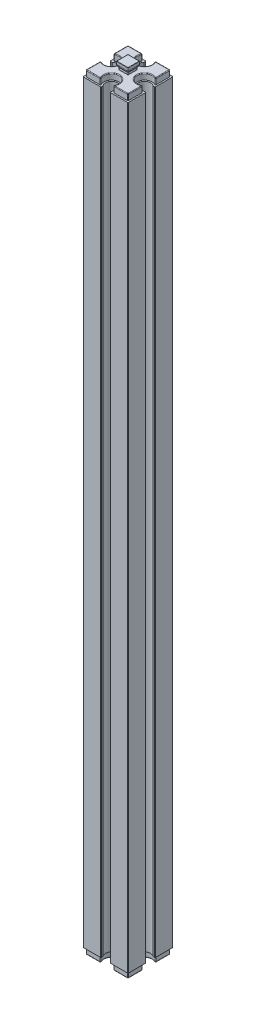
SolidWorks part; units mm, degrees
ref_plane "前视基准面" through (0, 0, 0) normal (0, 0, 1) x (1, 0, 0)
ref_plane "上视基准面" through (0, 0, 0) normal (0, 1, 0) x (1, 0, 0)
ref_plane "右视基准面" through (0, 0, 0) normal (1, 0, 0) x (0, 0, -1)
sketch "草图1" plane through (0, 0, 0) normal (0, 1, 0) x (1, 0, 0)
  line L0 (0, 0) -> (0, 7.5) construction
  line L1 (0, 0) -> (7.5, 0) construction
  line L2 (-7.5, 7.5) -> (-1.5, 7.5)
  line L3 (7.5, 7.5) -> (7.5, 1.5)
  line L4 (6.8229, 1.5) -> (7.5, 1.5)
  line L5 (6.8229, -1.5) -> (7.5, -1.5)
  line L6 (0, 7.5) -> (0, 5.5) construction
  line L7 (-1.5, 6.8229) -> (-1.5, 7.5)
  line L8 (1.5, 6.8229) -> (1.5, 7.5)
  line L9 (1.5, 7.5) -> (7.5, 7.5)
  line L10 (7.5, -1.5) -> (7.5, -7.5)
  line L11 (7.5, -7.5) -> (1.5, -7.5)
  line L12 (1.5, -6.8229) -> (1.5, -7.5)
  line L13 (-1.5, -6.8229) -> (-1.5, -7.5)
  line L14 (-1.5, -7.5) -> (-7.5, -7.5)
  line L15 (-7.5, -7.5) -> (-7.5, -1.5)
  line L16 (-6.8229, -1.5) -> (-7.5, -1.5)
  line L17 (-6.8229, 1.5) -> (-7.5, 1.5)
  line L18 (-7.5, 1.5) -> (-7.5, 7.5)
  arc A0 (-1.5, 6.8229) -> (1.5, 6.8229) centre (0, 5.5) ccw
  arc A1 (6.8229, 1.5) -> (6.8229, -1.5) centre (5.5, 0) ccw
  arc A2 (1.5, -6.8229) -> (-1.5, -6.8229) centre (0, -5.5) ccw
  arc A3 (-6.8229, -1.5) -> (-6.8229, 1.5) centre (-5.5, 0) ccw
  point P36 (0, 0)
  dimension "D6" = 4
  dimension "D7" = 2
  dimension "D1" = 7.5
  dimension "D2" = 7.5
  dimension "D3" = 2
  dimension "D4" = 7.5
  dimension "D5" = 1.5
extrude "凸台-拉伸1" add sketch "草图1" along normal blind 125.5
sketch "草图2" plane through (0, 125.5, 0) normal (0, 1, 0) x (1, 0, 0)
  line L0 (-7, 7) -> (-7, 2)
  line L1 (-7, 2) -> (-7, 2)
  line L2 (-7, -2) -> (-7, -2)
  line L3 (-7, -2) -> (-7, -7)
  line L4 (-7, -7) -> (-2, -7)
  line L5 (-2, -7) -> (-2, -7)
  line L6 (2, -7) -> (2, -7)
  line L7 (2, -7) -> (7, -7)
  line L8 (7, -7) -> (7, -2)
  line L9 (7, -2) -> (7, -2)
  line L10 (7, 2) -> (7, 2)
  line L11 (7, 2) -> (7, 7)
  line L12 (7, 7) -> (2, 7)
  line L13 (2, 7) -> (2, 7)
  line L14 (-2, 7) -> (-2, 7)
  line L15 (-2, 7) -> (-7, 7)
  line L16 (-7.5, 7.5) -> (-7.5, 1.5)
  line L17 (-7.5, 1.5) -> (-6.8229, 1.5)
  line L18 (-6.8229, -1.5) -> (-7.5, -1.5)
  line L19 (-7.5, -1.5) -> (-7.5, -7.5)
  line L20 (-7.5, -7.5) -> (-1.5, -7.5)
  line L21 (-1.5, -7.5) -> (-1.5, -6.8229)
  line L22 (1.5, -6.8229) -> (1.5, -7.5)
  line L23 (1.5, -7.5) -> (7.5, -7.5)
  line L24 (7.5, -7.5) -> (7.5, -1.5)
  line L25 (7.5, -1.5) -> (6.8229, -1.5)
  line L26 (6.8229, 1.5) -> (7.5, 1.5)
  line L27 (7.5, 1.5) -> (7.5, 7.5)
  line L28 (7.5, 7.5) -> (1.5, 7.5)
  line L29 (1.5, 7.5) -> (1.5, 6.8229)
  line L30 (-1.5, 6.8229) -> (-1.5, 7.5)
  line L31 (-1.5, 7.5) -> (-7.5, 7.5)
  line L32 (-7.5, 7.5) -> (-7.5, 1.5) construction
  line L33 (-7.5, 1.5) -> (-6.8229, 1.5) construction
  line L34 (-6.8229, -1.5) -> (-7.5, -1.5) construction
  line L35 (-7.5, -1.5) -> (-7.5, -7.5) construction
  line L36 (-7.5, -7.5) -> (-1.5, -7.5) construction
  line L37 (-1.5, -7.5) -> (-1.5, -6.8229) construction
  line L38 (1.5, -6.8229) -> (1.5, -7.5) construction
  line L39 (1.5, -7.5) -> (7.5, -7.5) construction
  line L40 (7.5, -7.5) -> (7.5, -1.5) construction
  line L41 (7.5, -1.5) -> (6.8229, -1.5) construction
  line L42 (6.8229, 1.5) -> (7.5, 1.5) construction
  line L43 (7.5, 1.5) -> (7.5, 7.5) construction
  line L44 (7.5, 7.5) -> (1.5, 7.5) construction
  line L45 (1.5, 7.5) -> (1.5, 6.8229) construction
  line L46 (-1.5, 6.8229) -> (-1.5, 7.5) construction
  line L47 (-1.5, 7.5) -> (-7.5, 7.5) construction
  arc A0 (-7, -2) -> (-7, 2) centre (-5.5, 0) ccw
  arc A1 (2, -7) -> (-2, -7) centre (0, -5.5) ccw
  arc A2 (7, 2) -> (7, -2) centre (5.5, 0) ccw
  arc A3 (-2, 7) -> (2, 7) centre (0, 5.5) ccw
  arc A4 (-6.8229, -1.5) -> (-6.8229, 1.5) centre (-5.5, 0) ccw
  arc A5 (1.5, -6.8229) -> (-1.5, -6.8229) centre (0, -5.5) ccw
  arc A6 (6.8229, 1.5) -> (6.8229, -1.5) centre (5.5, 0) ccw
  arc A7 (-1.5, 6.8229) -> (1.5, 6.8229) centre (0, 5.5) ccw
  arc A8 (-6.8229, -1.5) -> (-6.8229, 1.5) centre (-5.5, 0) ccw construction
  arc A9 (1.5, -6.8229) -> (-1.5, -6.8229) centre (0, -5.5) ccw construction
  arc A10 (6.8229, 1.5) -> (6.8229, -1.5) centre (5.5, 0) ccw construction
  arc A11 (-1.5, 6.8229) -> (1.5, 6.8229) centre (0, 5.5) ccw construction
  dimension "D1" = 0
  dimension "D2" = 0.5
extrude "凸台-拉伸2" add sketch "草图2" along normal blind 2
sketch "草图3" plane through (0, 0, 0) normal (1, 0, 0) x (0, 0, -1)
  line L0 (0, 127.5) -> (0, 129.5) construction
  line L1 (2.5, 127.5) -> (-2.5, 127.5) construction
  line L2 (0, 129.5) -> (0, 130) construction
  line L3 (-1.5, 127.5) -> (1.5, 127.5)
  line L4 (1.5, 127.5) -> (1.5, 128.1771)
  line L5 (-1.95, 130) -> (1.95, 130)
  line L6 (1.95, 130) -> (1.95, 129.0556)
  line L7 (-1.5, 127.5) -> (-1.5, 128.1771)
  line L8 (-1.95, 130) -> (-1.95, 129.0556)
  arc A0 (-1.5, 128.1771) -> (-1.95, 129.0556) centre (0, 129.5) cw
  arc A1 (1.5, 128.1771) -> (1.95, 129.0556) centre (0, 129.5) ccw
  dimension "D5" = 2
  dimension "D1" = 2
  dimension "D2" = 0.5
  dimension "D3" = 1.5
  dimension "D4" = 1.95
extrude "凸台-拉伸3" add sketch "草图3" along normal blind 2 and the other way blind 2
sketch "草图4" plane through (0, 0, 0) normal (0, 0, 1) x (1, 0, 0)
  line L0 (0, 127.5) -> (0, 129.5) construction
  line L2 (-2, 127.5) -> (2, 127.5) construction
  line L3 (0, 129.5) -> (0, 130) construction
  line L4 (-2, 130) -> (2, 130) construction
  line L5 (1.95, 130) -> (2, 130)
  line L6 (-1.95, 130) -> (-1.95, 129.0556)
  line L9 (-1.5, 127.5) -> (-1.5, 128.1771)
  line L10 (1.5, 127.5) -> (1.5, 128.1771)
  line L11 (1.95, 130) -> (1.95, 129.0556)
  line L12 (1.5, 127.5) -> (2, 127.5)
  line L13 (-2, 130) -> (-1.95, 130)
  line L14 (-2, 130) -> (-2, 127.5)
  line L15 (-2, 127.5) -> (-1.5, 127.5)
  line L16 (2, 130) -> (2, 127.5)
  arc A0 (-1.95, 129.0556) -> (-1.5, 128.1771) centre (0, 129.5) ccw
  arc A1 (1.95, 129.0556) -> (1.5, 128.1771) centre (0, 129.5) cw
  dimension "D1" = 2
  dimension "D2" = 1.5
  dimension "D3" = 1.95
fillet "圆角3" radius 0.2 13 edges at (-1.5, 62.75, -7.5) (1.5, 62.75, -7.5) (7.5, 62.75, -7.5) (7.5, 62.75, -1.5) (7.5, 62.75, 1.5) (7.5, 62.75, 7.5) (-1.5, 62.75, 7.5) (1.5, 62.75, 7.5) (-6.8229, 62.75, -1.5) (-7.5, 62.75, 7.5) (-7.5, 62.75, 1.5) (-7.5, 62.75, -1.5) (-7.5, 62.75, -7.5)
extrude "切除-拉伸1" cut sketch "草图4" against normal blind 3 and the other way blind 3
fillet "圆角4" radius 0.2 24 edges at (0, 127.5, 3) (-3, 127.5, 0) (0, 127.5, -3) (3, 127.5, 0) (7, 126.5, 2) (7, 126.5, -2) (2, 126.5, -7) (-2, 126.5, -7) (-7, 126.5, 2) (-7, 126.5, -2) (2, 126.5, 7) (-2, 126.5, 7) (7, 126.5, 7) (4.5, 127.5, 7) (7, 127.5, 4.5) (7, 127.5, -4.5) (7, 126.5, -7) (4.5, 127.5, -7) (-4.5, 127.5, -7) (-7, 126.5, -7) (-7, 127.5, -4.5) (-4.5, 127.5, 7) (-7, 127.5, 4.5) (-7, 126.5, 7)
fillet "圆角5" radius 0.1 4 edges at (0, 130, -1.95) (1.95, 130, 0) (0, 130, 1.95) (-1.95, 130, 0)
mirror "镜向1" of "圆角5", "圆角4", "切除-拉伸1", "圆角3", "凸台-拉伸3", "凸台-拉伸2", "凸台-拉伸1"
